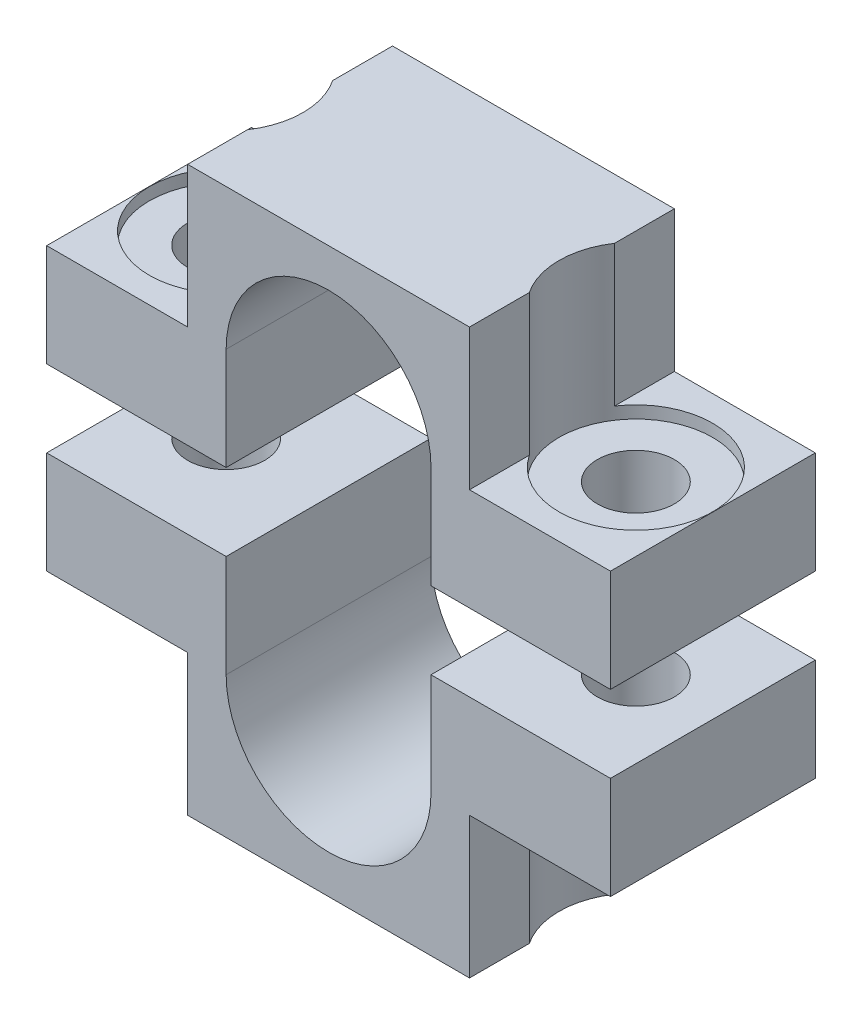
SolidWorks part; units mm, degrees
ref_plane "Front Plane" through (0, 0, 0) normal (0, 0, 1) x (1, 0, 0)
ref_plane "Top Plane" through (0, 0, 0) normal (0, 1, 0) x (1, 0, 0)
ref_plane "Right Plane" through (0, 0, 0) normal (1, 0, 0) x (0, 0, -1)
sketch "Sketch1" plane through (0, 0, 0) normal (0, 0, 1) x (1, 0, 0)
  line L0 (0, 0) -> (0, 6.35) construction
  line L1 (6.35, 0) -> (6.35, -6.35)
  line L2 (6.35, -6.35) -> (17.4752, -6.35)
  line L3 (17.4752, -6.35) -> (17.4752, 0)
  line L4 (17.4752, 0) -> (8.7376, 0)
  line L5 (8.7376, 0) -> (8.7376, 8.7376)
  line L6 (8.7376, 8.7376) -> (-8.7376, 8.7376)
  line L7 (-8.7376, 8.7376) -> (-8.7376, 0)
  line L8 (-8.7376, 0) -> (-17.4752, 0)
  line L9 (-17.4752, 0) -> (-17.4752, -6.35)
  line L10 (-17.4752, -6.35) -> (-6.35, -6.35)
  line L11 (-6.35, -6.35) -> (-6.35, 0)
  line L12 (-12.7, 0) -> (-12.7, -6.35)
  line L13 (12.7, 0) -> (12.7, -6.35)
  circle A0 centre (0, 0) radius 6.35
  dimension "D1" = 12.7
  dimension "D2" = 2.3876
  dimension "D3" = 11.1252
  dimension "D4" = 6.35
  dimension "D5" = 17.4752
  dimension "D6" = 3.9624
sketch "Sketch2" plane through (0, 0, 0) normal (0, 0, 1) x (1, 0, 0)
  line L0 (6.35, 0) -> (6.35, -6.35) construction
  line L1 (6.35, -6.35) -> (17.4752, -6.35) construction
  line L2 (17.4752, -6.35) -> (17.4752, 0) construction
  line L3 (17.4752, 0) -> (8.7376, 0) construction
  line L4 (8.7376, 0) -> (8.7376, 8.7376) construction
  line L5 (8.7376, 8.7376) -> (-8.7376, 8.7376) construction
  line L6 (-8.7376, 8.7376) -> (-8.7376, 0) construction
  line L7 (-8.7376, 0) -> (-17.4752, 0) construction
  line L8 (-17.4752, 0) -> (-17.4752, -6.35) construction
  line L9 (-17.4752, -6.35) -> (-6.35, -6.35) construction
  line L10 (-6.35, -6.35) -> (-6.35, 0) construction
  line L11 (6.35, 0) -> (6.35, -6.35)
  line L12 (6.35, -6.35) -> (17.4752, -6.35)
  line L13 (17.4752, -6.35) -> (17.4752, 0)
  line L14 (17.4752, 0) -> (8.7376, 0)
  line L15 (8.7376, 0) -> (8.7376, 8.7376)
  line L16 (8.7376, 8.7376) -> (-8.7376, 8.7376)
  line L17 (-8.7376, 8.7376) -> (-8.7376, 0)
  line L18 (-8.7376, 0) -> (-17.4752, 0)
  line L19 (-17.4752, 0) -> (-17.4752, -6.35)
  line L20 (-17.4752, -6.35) -> (-6.35, -6.35)
  line L21 (-6.35, -6.35) -> (-6.35, 0)
  circle A0 centre (0, 0) radius 6.35 construction
  arc A1 (6.35, 0) -> (-6.35, 0) centre (0, 0) ccw
extrude "Boss-Extrude1" add sketch "Sketch2" along normal mid plane 12.7
sketch "Sketch4" plane through (0, 0, 0) normal (0, 1, 0) x (1, 0, 0)
  circle A0 centre (-12.7, 0) radius 2.3876
  circle A1 centre (12.7, 0) radius 2.3876
  dimension "D1" = 4.7752
extrude "Cut-Extrude1" cut sketch "Sketch4" against normal blind 12.7 and the other way blind 5.08
fillet "Fillet1" [suppressed] radius 6.35
sketch "Sketch5" plane through (0, 0, 0) normal (0, 1, 0) x (1, 0, 0)
  circle A0 centre (-12.7, 0) radius 4.7625
  circle A1 centre (12.7, 0) radius 4.7625
  dimension "D1" = 9.525
extrude "Cut-Extrude2" cut sketch "Sketch5" along normal blind 12.7 and the other way blind 0.762
ref_plane "Plane1" through (0, -8.7376, 0) normal (0, -1, 0) x (-1, 0, 0)
mirror "Mirror1" about plane through (0, -8.7376, 0) normal (0, -1, 0)
